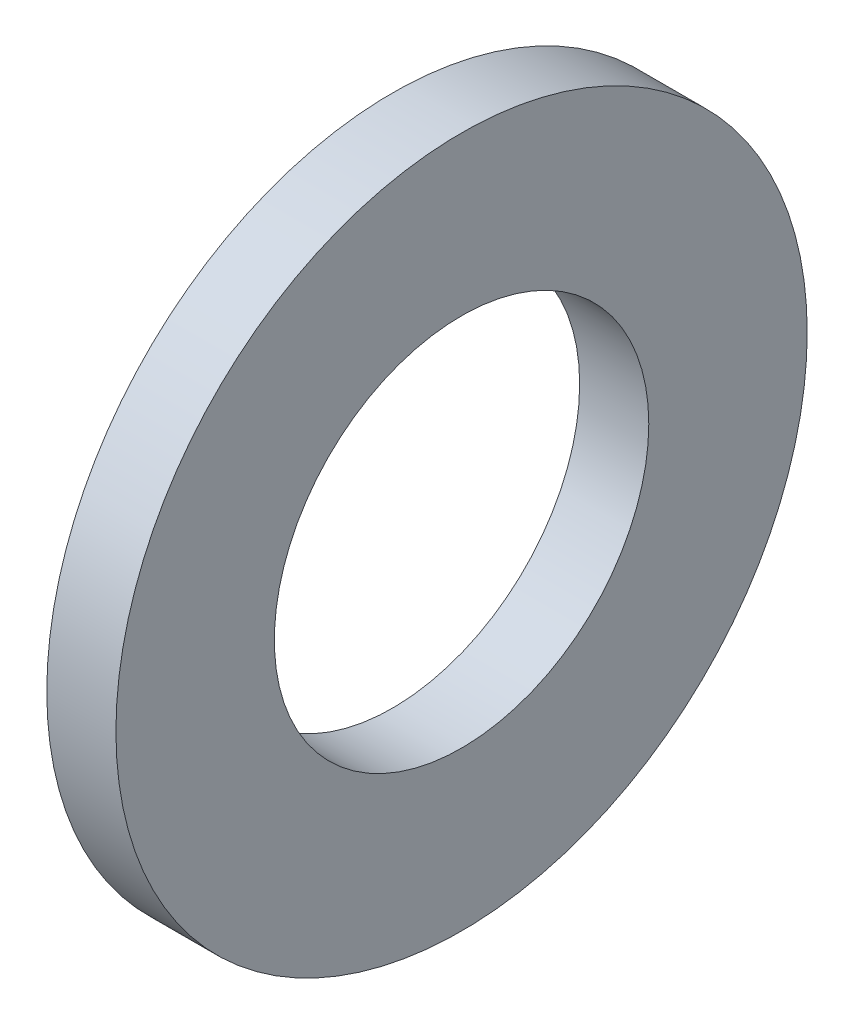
SolidWorks part; units mm, degrees
ref_plane "Face" through (0, 0, 0) normal (0, 0, 1) x (1, 0, 0)
ref_plane "Dessus" through (0, 0, 0) normal (0, 1, 0) x (1, 0, 0)
ref_plane "Droite" through (0, 0, 0) normal (1, 0, 0) x (0, 0, -1)
sketch "Esquisse1" plane through (0, 0, 0) normal (1, 0, 0) x (0, 0, -1)
  circle A0 centre (0, 0) radius 6
extrude "Base-Extrusion" add sketch "Esquisse1" along normal blind 1.2
sketch "Esquisse2" plane through (1.2, 0, 0) normal (1, 0, 0) x (0, 0, -1)
  circle A0 centre (0, 0) radius 3.25
extrude "Enlèv. mat.-Extru.1" cut sketch "Esquisse2" against normal through all
